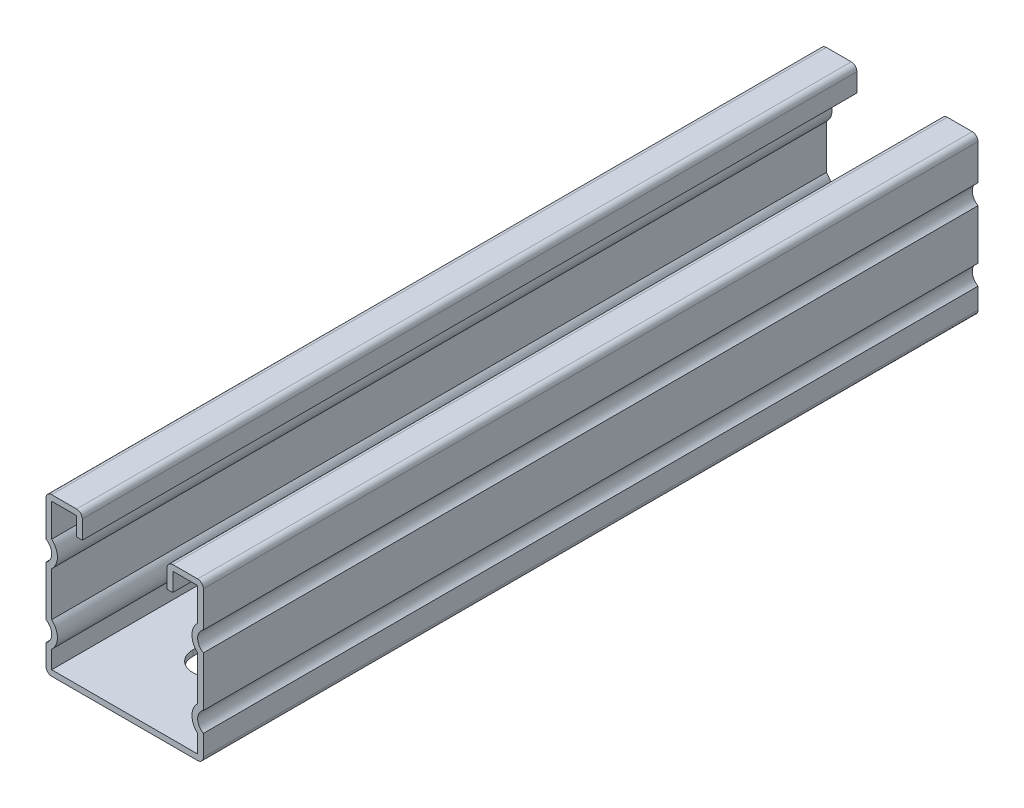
SolidWorks part; units mm, degrees
ref_plane "Plane1" through (0, 0, 0) normal (0, 0, 1) x (1, 0, 0)
ref_plane "Plane2" through (0, 0, 0) normal (0, 1, 0) x (1, 0, 0)
ref_plane "Plane3" through (0, 0, 0) normal (1, 0, 0) x (0, 0, -1)
sketch "Sketch1" plane through (0, 0, 0) normal (0, 0, 1) x (1, 0, 0)
  line L0 (-20.6375, 21.1074) -> (-20.6375, 11.7397)
  line L1 (-20.6375, 6.5483) -> (-20.6375, -6.5483)
  line L2 (-19.1389, -18.669) -> (19.1389, -18.669)
  line L3 (20.6375, -17.1704) -> (20.6375, -11.7397)
  line L4 (20.6375, 11.7397) -> (20.6375, 21.1074)
  line L5 (19.1389, 22.606) -> (12.6111, 22.606)
  line L6 (11.1125, 21.1074) -> (11.1125, 16.256)
  line L7 (-19.1389, 22.606) -> (-12.6111, 22.606)
  line L8 (-11.1125, 21.1074) -> (-11.1125, 16.256)
  line L9 (19.1389, -12.495) -> (19.1389, 12.495) construction
  line L10 (-19.1389, 12.495) -> (-19.1389, -12.495) construction
  line L11 (-12.6111, 21.1074) -> (-12.6111, 16.256)
  line L12 (-19.1389, 21.1074) -> (-12.6111, 21.1074)
  line L13 (-19.1389, 21.1074) -> (-19.1389, 12.495)
  line L14 (-19.1389, 5.793) -> (-19.1389, -5.793)
  line L15 (-19.1389, -17.1704) -> (19.1389, -17.1704)
  line L16 (19.1389, -17.1704) -> (19.1389, -12.495)
  line L17 (19.1389, 12.495) -> (19.1389, 21.1074)
  line L18 (19.1389, 21.1074) -> (12.6111, 21.1074)
  line L19 (12.6111, 21.1074) -> (12.6111, 16.256)
  line L20 (-12.6111, 16.256) -> (-11.1125, 16.256)
  line L21 (11.1125, 16.256) -> (12.6111, 16.256)
  line L22 (-10.16, 0) -> (12.7, 0) construction
  line L23 (-20.6375, -11.7397) -> (-20.6375, -17.1704)
  line L24 (-19.1389, -12.495) -> (-19.1389, -17.1704)
  line L25 (20.6375, -6.5483) -> (20.6375, 6.5483)
  line L26 (19.1389, -5.793) -> (19.1389, 5.793)
  arc A0 (20.6375, 11.7397) -> (20.6375, 6.5483) centre (22.1361, 9.144) ccw
  arc A1 (-20.6375, 6.5483) -> (-20.6375, 11.7397) centre (-22.1361, 9.144) ccw
  arc A2 (-12.6111, 22.606) -> (-11.1125, 21.1074) centre (-12.6111, 21.1074) cw
  arc A3 (-20.6375, 21.1074) -> (-19.1389, 22.606) centre (-19.1389, 21.1074) cw
  arc A4 (-19.1389, -18.669) -> (-20.6375, -17.1704) centre (-19.1389, -17.1704) cw
  arc A5 (20.6375, -17.1704) -> (19.1389, -18.669) centre (19.1389, -17.1704) cw
  arc A6 (19.1389, 22.606) -> (20.6375, 21.1074) centre (19.1389, 21.1074) cw
  arc A7 (11.1125, 21.1074) -> (12.6111, 22.606) centre (12.6111, 21.1074) cw
  arc A8 (-19.1389, 5.793) -> (-19.1389, 12.495) centre (-22.1361, 9.144) ccw
  arc A9 (19.1389, 12.495) -> (19.1389, 5.793) centre (22.1361, 9.144) ccw
  arc A10 (20.6375, -11.7397) -> (20.6375, -6.5483) centre (22.1361, -9.144) cw
  arc A11 (19.1389, -12.495) -> (19.1389, -5.793) centre (22.1361, -9.144) cw
  arc A12 (-19.1389, -5.793) -> (-19.1389, -12.495) centre (-22.1361, -9.144) cw
  arc A13 (-20.6375, -6.5483) -> (-20.6375, -11.7397) centre (-22.1361, -9.144) cw
  dimension "D1" = 20.6375
  dimension "D9" = 2.9972
  dimension "D10" = 2.9972
  dimension "D2" = 9.525
  dimension "Width" = 41.275
  dimension "base" = 18.669
  dimension "ToeHt" = 22.606
  dimension "D6" = 22.225
  dimension "edge" = 9.525
  dimension "Lip" = 6.35
  dimension "gauge" = 1.4986
extrude "Base-Extrude" add sketch "Sketch1" along normal blind 203.2
extrude "Slot" cut sketch "Sketch2" against normal through all
sketch "Sketch2" plane through (1.1214, -18.669, -18.7802) normal (0, -1, 0) x (1, 0, 0)
  line L0 (4.038, 97.3614) -> (4.038, 31.4802)
  line L1 (-6.2808, 31.4802) -> (-6.2808, 97.3614)
  arc A0 (-6.2808, 31.4802) -> (4.038, 31.4802) centre (-1.1214, 31.4802) ccw
  arc A1 (4.038, 97.3614) -> (-6.2808, 97.3614) centre (-1.1214, 97.3614) ccw
  dimension "D3" = 10.3187
  dimension "D1" = 12.7
  dimension "D2" = 65.8813
pattern_linear "LPattern1" count 2 spacing 101.6 along (0, 0, 1) of "Slot"
equation "\"D1@Sketch1\" = \"Width@Sketch1\" / 2"
equation "\"D6@Sketch1\" = \"Width@Sketch1\" - 2 * \"edge@Sketch1\""
equation "\"D10@Sketch1\" = 2 * \"gauge@Sketch1\""
equation "\"D9@Sketch1\" = \"D10@Sketch1\""
equation "\"D2@Sketch1\" = \"edge@Sketch1\""
equation "\"D1@LPattern1\" = \"D1@Base-Extrude\" / \"D3@LPattern1\""
